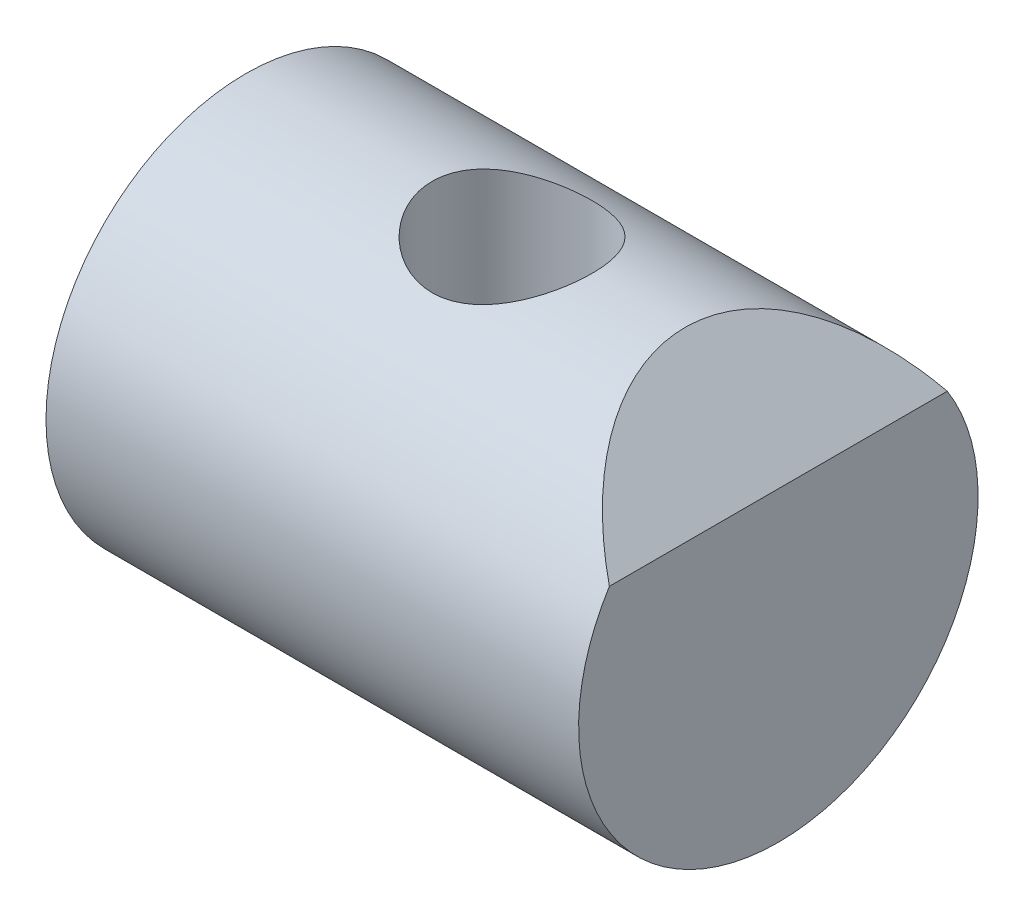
SolidWorks part; units mm, degrees
ref_plane "Face" through (0, 0, 0) normal (0, 0, 1) x (1, 0, 0)
ref_plane "Dessus" through (0, 0, 0) normal (0, 1, 0) x (1, 0, 0)
ref_plane "Droite" through (0, 0, 0) normal (1, 0, 0) x (0, 0, -1)
sketch "Esquisse1" plane through (0, 0, 0) normal (0, 0, 1) x (1, 0, 0)
  line L1 (-20, 15) -> (20, 15)
  line L2 (-20, 15) -> (-20, -15)
  line L3 (-20, -15) -> (20, -15)
  line L4 (20, 15) -> (20, -15)
  dimension "D1" = 40
  dimension "D2" = 30
  dimension "D3" = 20
  dimension "D4" = 15
extrude "Base-Extrusion" add sketch "Esquisse1" along normal blind 30
hole_wizard "Trou taraudé M12x1.751" positions "Esquisse3" profile "Esquisse2" tap size "M12x1.75" standard "ISO"
sketch "Esquisse3" plane through (0, 15, 0) normal (0, 1, 0) x (-1, 0, 0)
  line L0 (-20, 30) -> (-20, 0) construction
  line L1 (-20, 30) -> (20, 30) construction
  point P0 (0, 15)
  dimension "D1" = 20
  dimension "D2" = 15
sketch "Esquisse2" plane through (0, 15, 15) normal (1, 0, 0) x (0, 0, 1)
  line L0 (0, 0) -> (0, 30)
  line L1 (0, 30) -> (6, 30)
  line L2 (6, 30) -> (6, 0)
  line L5 (6, 0) -> (0, 0)
  line L11 (0, -6.35) -> (0, 107.95) construction
  dimension "Diamètre du perçage jusqu'au prochain" = 12
  dimension "Profondeur du perçage jusqu'au prochain" = 30
sketch "Esquisse4" plane through (0, 0, 30) normal (0, 0, 1) x (1, 0, 0)
  line L1 (13, 15) -> (20, 15)
  line L4 (20, 15) -> (20, 8)
  line L5 (13, 15) -> (20, 8)
extrude "Enlèv. mat.-Extru.1" cut sketch "Esquisse4" against normal through all
sketch "Esquisse5" plane through (-20, 0, 0) normal (-1, 0, 0) x (0, 0, 1)
  line L0 (0, 15) -> (0, -15) construction
  line L1 (30, -15) -> (0, -15) construction
  circle A0 centre (15, 0) radius 15
  dimension "D1" = 30
  dimension "D2" = 15
  dimension "D3" = 15
extrude "Enlèv. mat.-Extru.2" cut sketch "Esquisse5" against normal through all flip side to cut
